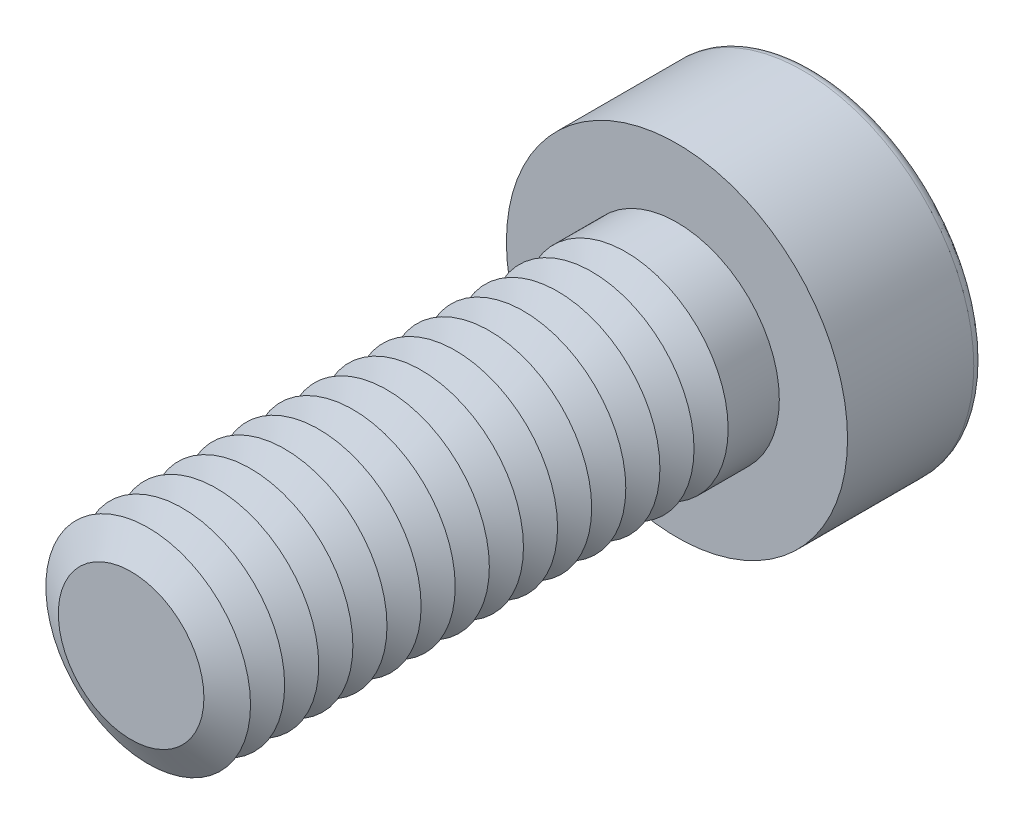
SolidWorks part; units mm, degrees
ref_plane "Front Plane" through (0, 0, 0) normal (0, 0, 1) x (1, 0, 0)
ref_plane "Top Plane" through (0, 0, 0) normal (0, 1, 0) x (1, 0, 0)
ref_plane "Right Plane" through (0, 0, 0) normal (1, 0, 0) x (0, 0, -1)
sketch "Sketch1" plane through (0, 0, 0) normal (0, 0, 1) x (1, 0, 0)
  circle A0 centre (0, 0) radius 3
  dimension "D1" = 6
extrude "Boss-Extrude1" add sketch "Sketch1" along normal blind 16
sketch "Sketch2" plane through (0, 0, 0) normal (0, 0, -1) x (-1, 0, 0)
  circle A0 centre (0, 0) radius 5
  dimension "D1" = 10
extrude "Boss-Extrude2" add sketch "Sketch2" along normal blind 4
sketch "Sketch3" plane through (0, 0, -4) normal (0, 0, -1) x (-1, 0, 0)
  line L1 (-1.1547, 2) -> (-2.3094, 0)
  line L2 (-2.3094, 0) -> (-1.1547, -2)
  line L3 (-1.1547, -2) -> (1.1547, -2)
  line L4 (1.1547, -2) -> (2.3094, 0)
  line L5 (2.3094, 0) -> (1.1547, 2)
  line L6 (1.1547, 2) -> (-1.1547, 2)
  circle A0 centre (0, 0) radius 2 construction
  dimension "D1" = 4
extrude "Cut-Extrude1" cut sketch "Sketch3" against normal blind 3
fillet "Fillet1" radius 0.3 1 edges at (-5, 0, -4)
sketch "Sketch4" plane through (0, 0, -1) normal (0, 0, -1) x (-1, 0, 0)
  line L0 (1.1547, -2) -> (2.3094, 0) construction
  circle A0 centre (0, 0) radius 2
extrude "Cut-Extrude2" cut sketch "Sketch4" against normal through all draft 60
sketch "Sketch5" plane through (0, 0, -4) normal (0, 0, -1) x (-1, 0, 0)
  circle A0 centre (0, 0) radius 2.3094
extrude "Cut-Extrude3" cut sketch "Sketch5" against normal through all draft 75
sketch "Sketch7" plane through (0, 0, 0) normal (1, 0, 0) x (0, 0, -1)
  line L25 (-16, 2.134) -> (-15.5, 3)
  line L26 (-16, 3) -> (-16, -3) construction
  line L27 (-15.5, 3) -> (-16.5, 3)
  line L28 (-16.5, 3) -> (-16, 2.134)
  line L29 (0, 3) -> (-16, 3) construction
  dimension "D1" = 1
revolve "Cut-Revolve1" cut sketch "Sketch7" angle 360 about axis through (0, 0, 16) along (0, 0, -1)
pattern_linear "LPattern1" count 15 spacing 1 along (0, 0, -1) of "Cut-Revolve1"
